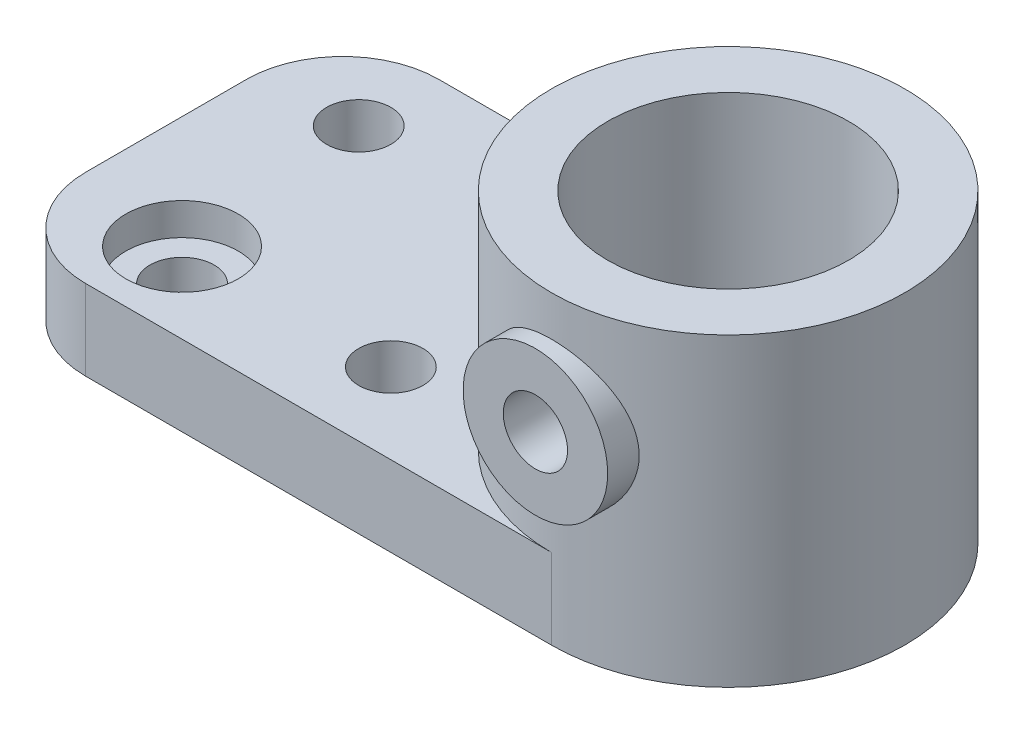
SolidWorks part; units mm, degrees
ref_plane "前视基准面" through (0, 0, 0) normal (0, 0, 1) x (1, 0, 0)
ref_plane "上视基准面" through (0, 0, 0) normal (0, 1, 0) x (1, 0, 0)
ref_plane "右视基准面" through (0, 0, 0) normal (1, 0, 0) x (0, 0, -1)
sketch "草图1" plane through (0, 0, 0) normal (0, 1, 0) x (1, 0, 0)
  line L0 (-96.7006, 0) -> (70.0357, 0) construction
  line L1 (0, 80.4768) -> (0, -76.9429) construction
  line L2 (0, 22) -> (-70, 22)
  line L3 (-70, 22) -> (-70, -22)
  line L4 (0, -22) -> (-70, -22)
  line L5 (-58, 19.4365) -> (-58, 5.9434) construction
  line L6 (-32, 19.4365) -> (-32, 5.9434) construction
  line L7 (-56, 0) -> (-56, -31.3233) construction
  line L8 (-30, -2.7307) -> (-30, -41.925) construction
  line L9 (-63.6104, 12) -> (-20.2397, 12) construction
  line L10 (-75.8184, -12) -> (-17.027, -12) construction
  arc A0 (0, -22) -> (0, 22) centre (0, 0) ccw
  circle A1 centre (0, 0) radius 7
  circle A2 centre (-58, 12) radius 4
  circle A3 centre (-32, 12) radius 4
  circle A4 centre (-56, -12) radius 4
  circle A5 centre (-30, -12) radius 4
  point P11 (-70, 0)
  dimension "D1" = 44
  dimension "D3" = 14
  dimension "D10" = 8
  dimension "D2" = 70
  dimension "D4" = 32
  dimension "D5" = 26
  dimension "D6" = 30
  dimension "D7" = 56
  dimension "D8" = 12
  dimension "D9" = 12
extrude "凸台-拉伸1" add sketch "草图1" along normal blind 10
sketch "草图2" plane through (0, 10, 0) normal (0, 1, 0) x (1, 0, 0)
  circle A0 centre (0, 0) radius 15
  circle A1 centre (0, 0) radius 22
  dimension "D1" = 30
  dimension "D2" = 44
extrude "凸台-拉伸2" add sketch "草图2" along normal blind 28
fillet "圆角1" radius 12 2 edges at (-70, 5, -22) (-70, 5, 22)
sketch "草图3" plane through (0, 10, 0) normal (0, 1, 0) x (1, 0, 0)
  circle A0 centre (-56, -12) radius 7
  circle A1 centre (-32, 12) radius 7
  dimension "D1" = 14
  dimension "D2" = 14
extrude "切除-拉伸1" cut sketch "草图3" against normal blind 4
ref_plane "基准面1" through (0, 0, 24) normal (0, 0, 1) x (1, 0, 0)
sketch "草图4" plane through (0, 0, 24) normal (0, 0, 1) x (1, 0, 0)
  circle A0 centre (0, 24) radius 9
  dimension "D2" = 18
  dimension "D1" = 24
extrude "凸台-拉伸3" add sketch "草图4" against normal up to next
sketch "草图5" plane through (0, 0, 24) normal (0, 0, 1) x (1, 0, 0)
  circle A0 centre (0, 24) radius 4
  dimension "D1" = 8
extrude "切除-拉伸2" cut sketch "草图5" against normal blind 13
ref_plane "基准面2" through (0, 24, 0) normal (0, 1, 0) x (-1, 0, 0)
